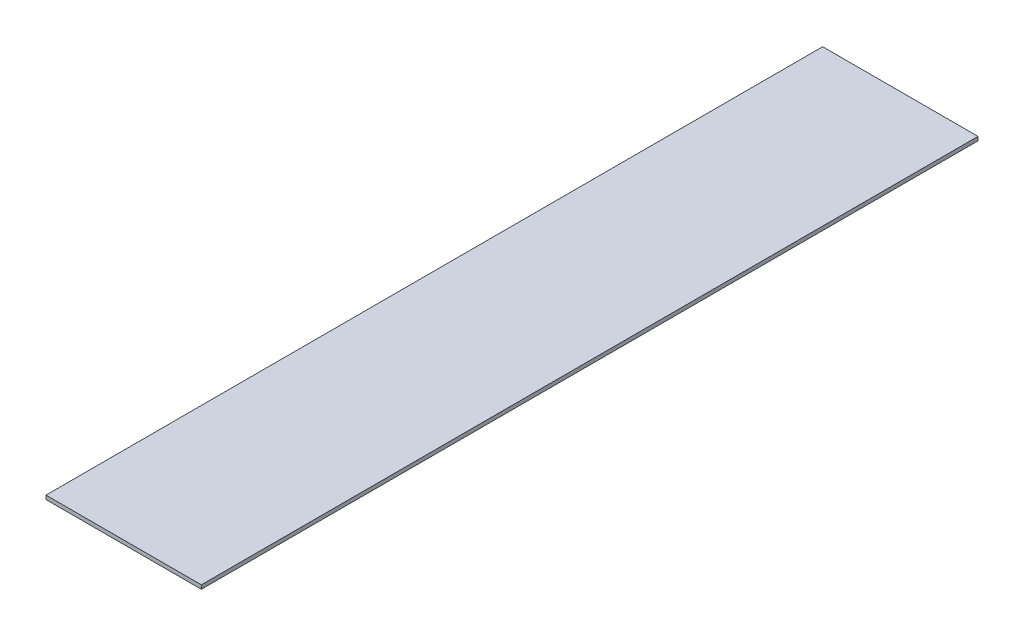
SolidWorks part; units mm, degrees
ref_plane "Vorne" through (0, 0, 0) normal (0, 0, 1) x (1, 0, 0)
ref_plane "Oben" through (0, 0, 0) normal (0, 1, 0) x (1, 0, 0)
ref_plane "Rechts" through (0, 0, 0) normal (1, 0, 0) x (0, 0, -1)
sketch "Skizze1" plane through (0, 0, 0) normal (0, 0, 1) x (1, 0, 0)
  line L1 (-10, -0.25) -> (10, -0.25)
  line L2 (-10, -0.25) -> (-10, 0.25)
  line L3 (-10, 0.25) -> (10, 0.25)
  line L4 (10, -0.25) -> (10, 0.25)
  line L5 (-10, -0.25) -> (10, 0.25) construction
  line L6 (-10, 0.25) -> (10, -0.25) construction
  point P0 (0, 0)
  dimension "D1" = 20
  dimension "D2" = 0.5
extrude "Linear austragen1" add sketch "Skizze1" along normal blind 100
